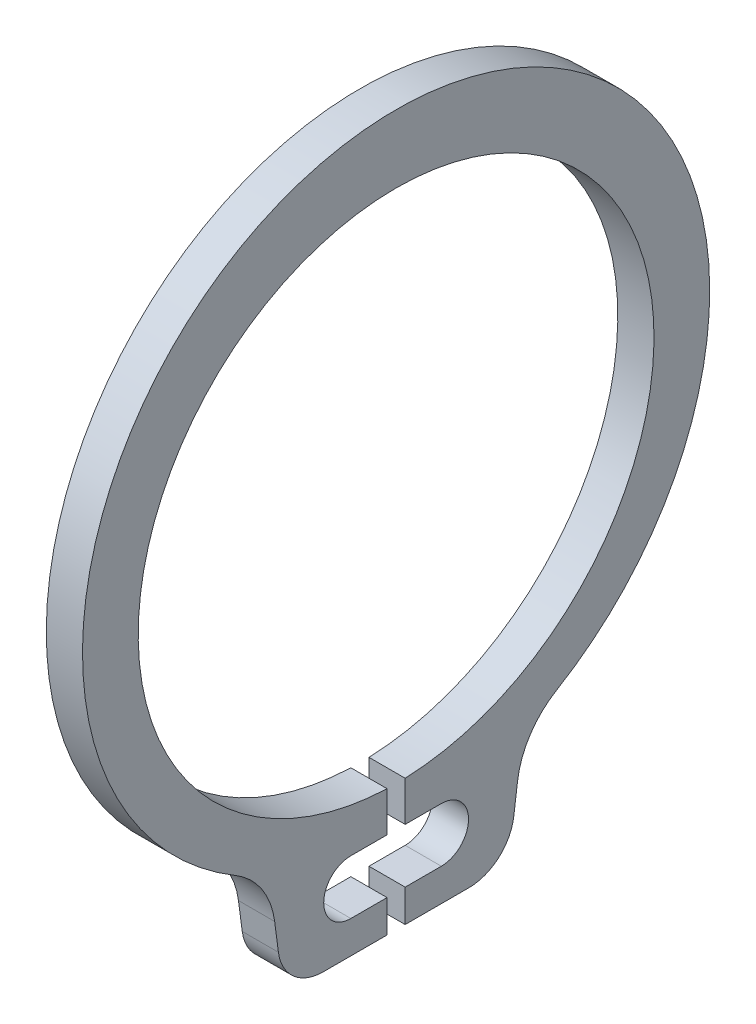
SolidWorks part; units mm, degrees
ref_plane "Front Plane" through (0, 0, 0) normal (0, 0, 1) x (1, 0, 0)
ref_plane "Top Plane" through (0, 0, 0) normal (0, 1, 0) x (1, 0, 0)
ref_plane "Right Plane" through (0, 0, 0) normal (1, 0, 0) x (0, 0, -1)
sketch "Sketch1" plane through (0, 0, 0) normal (1, 0, 0) x (0, 0, -1)
  line L0 (0, 0) -> (0, -10.9681) construction
  line L1 (-0.1, -4.2488) -> (-0.1, -2.8482)
  line L2 (0.1, -2.8482) -> (0.1, -4.2488)
  line L3 (0.1, -4.2488) -> (0.8046, -4.2488)
  line L4 (1.3419, -3.498) -> (1.3003, -3.8141)
  line L5 (-1.3419, -3.498) -> (-1.3003, -3.8141)
  line L6 (-0.1, -4.2488) -> (-0.8046, -4.2488)
  circle A0 centre (0, 0) radius 2.85 construction
  arc A1 (0.1, -2.8482) -> (-0.1, -2.8482) centre (0, 0) ccw
  arc A2 (1.761, -2.8498) -> (-1.761, -2.8498) centre (0, 0.1347) ccw construction
  arc A3 (0.1, -4.2488) -> (0.3664, -4.2342) centre (0, 0) ccw construction
  arc A4 (1.7735, -2.8424) -> (1.3419, -3.498) centre (2.234, -3.6155) ccw
  arc A5 (-1.3419, -3.498) -> (-1.7735, -2.8424) centre (-2.234, -3.6155) ccw
  arc A6 (-2.8195, -3.1801) -> (-0.1, -4.2488) centre (0, 0) ccw construction
  arc A7 (1.7735, -2.8424) -> (-1.7735, -2.8424) centre (0, 0.1347) ccw
  circle A8 centre (0.5, -3.5904) radius 0.3
  circle A9 centre (-0.5, -3.5904) radius 0.3
  arc A10 (1.3003, -3.8141) -> (0.8046, -4.2488) centre (0.8046, -3.7488) cw
  arc A11 (-1.3003, -3.8141) -> (-0.8046, -4.2488) centre (-0.8046, -3.7488) ccw
  dimension "D1" = 5.7
  dimension "D2" = 4.25
  dimension "D7" = 0.8999
  dimension "D9" = 0.1347
  dimension "D6" = 0.2
  dimension "D8" = 3.4653
  dimension "D4" = 0.6
  dimension "D5" = 0.5
  dimension "D3" = 1
  dimension "D10" = 15
  dimension "D11" = 0.6585
  dimension "D12" = 1.6091
extrude "Boss-Extrude1" add sketch "Sketch1" along normal mid plane 0.4
sketch "Sketch2" plane through (0.2, 0, 0) normal (1, 0, 0) x (0, 0, -1)
  line L0 (-0.5, -3.2904) -> (-0.5, -3.8904) construction
  line L1 (-0.5, -3.2904) -> (0.5, -3.2904)
  line L2 (-0.5, -3.2904) -> (-0.5, -3.8904)
  line L3 (-0.5, -3.8904) -> (0.5, -3.8904)
  line L4 (0.5, -3.2904) -> (0.5, -3.8904)
  circle A0 centre (-0.5, -3.5904) radius 0.3 construction
  circle A1 centre (0.5, -3.5904) radius 0.3 construction
extrude "Cut-Extrude1" cut sketch "Sketch2" against normal blind 10
